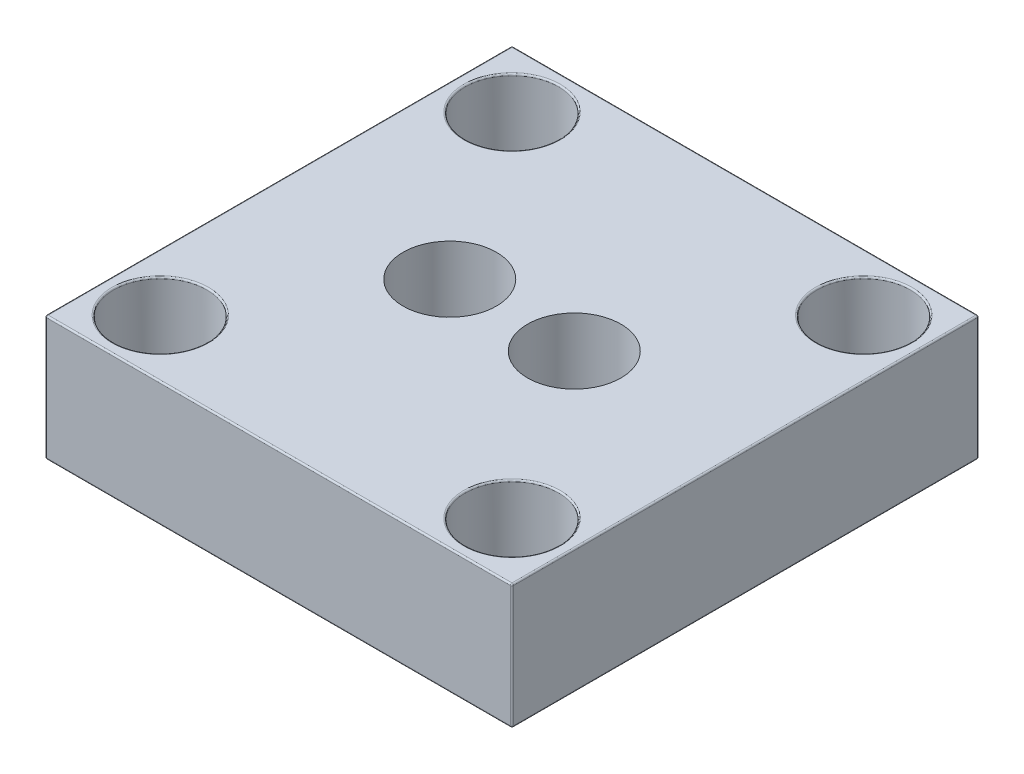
SolidWorks part; units mm, degrees
ref_plane "Front Plane" through (0, 0, 0) normal (0, 0, 1) x (1, 0, 0)
ref_plane "Top Plane" through (0, 0, 0) normal (0, 1, 0) x (1, 0, 0)
ref_plane "Right Plane" through (0, 0, 0) normal (1, 0, 0) x (0, 0, -1)
sketch "Sketch1" plane through (0, 0, 0) normal (0, 1, 0) x (1, 0, 0)
  line L1 (0, 0) -> (75, 0)
  line L2 (0, 0) -> (0, 75)
  line L3 (0, 75) -> (75, 75)
  line L4 (75, 0) -> (75, 75)
  dimension "D1" = 75
  dimension "D2" = 75
extrude "Boss-Extrude1" add sketch "Sketch1" along normal blind 20
sketch "Sketch2" plane through (0, 20, 0) normal (0, 1, 0) x (-1, 0, 0)
  line L0 (-37.5, -75) -> (-37.5, 0) construction
  line L1 (-75, -75) -> (0, -75) construction
  line L2 (0, 0) -> (-75, 0) construction
  line L4 (-75, 0) -> (-75, -75) construction
  line L5 (-75, -37.5) -> (0, -37.5) construction
  line L6 (0, -75) -> (0, 0) construction
  circle A0 centre (-27.5, -37.5) radius 4.5
  circle A1 centre (-9.25, -65.75) radius 4.5
  circle A2 centre (-9.25, -9.25) radius 4.5
  circle A3 centre (-65.75, -9.25) radius 4.5
  circle A4 centre (-47.5, -37.5) radius 4.5
  circle A5 centre (-65.75, -65.75) radius 4.5
  dimension "D1" = 9
  dimension "D2" = 9
  dimension "D3" = 9
  dimension "D4" = 10
  dimension "D5" = 28.25
  dimension "D6" = 28.25
  dimension "D7" = 56.5
  dimension "D8" = 28.25
extrude "Cut-Extrude1" cut sketch "Sketch2" against normal through all
sketch "Sketch3" plane through (0, 20, 0) normal (0, 1, 0) x (1, 0, 0)
  circle A2 centre (65.75, 65.75) radius 7.5
  circle A3 centre (9.25, 65.75) radius 7.5
  circle A4 centre (9.25, 9.25) radius 7.5
  circle A5 centre (65.75, 9.25) radius 7.5
  dimension "D1" = 15
  dimension "D3" = 15
  dimension "D5" = 15
  dimension "D6" = 15
extrude "Cut-Extrude2" cut sketch "Sketch3" against normal blind 12
fillet "Fillet1" radius 0.25 24 edges at (27.5, 0, -33) (9.25, 0, -61.25) (9.25, 0, -4.75) (65.75, 0, -13.75) (47.5, 0, -42) (65.75, 0, -70.25) (0, 0, -37.5) (0, 10, -75) (37.5, 0, -75) (75, 10, -75) (75, 0, -37.5) (0, 10, 0) (75, 10, 0) (37.5, 0, 0) (37.5, 20, -75) (75, 20, -37.5) (37.5, 20, 0) (0, 20, -37.5) (65.75, 20, -58.25) (9.25, 20, -58.25) (9.25, 20, -1.75) (65.75, 20, -1.75) (27.5, 20, -33) (47.5, 20, -42)
sketch "Sketch4" plane through (0, 20, 0) normal (0, 1, 0) x (1, 0, 0)
  circle A0 centre (27.5, 37.5) radius 7.5
  circle A1 centre (47.5, 37.5) radius 7.5
  dimension "D1" = 15
  dimension "D2" = 15
extrude "Cut-Extrude3" cut sketch "Sketch4" against normal blind 14
